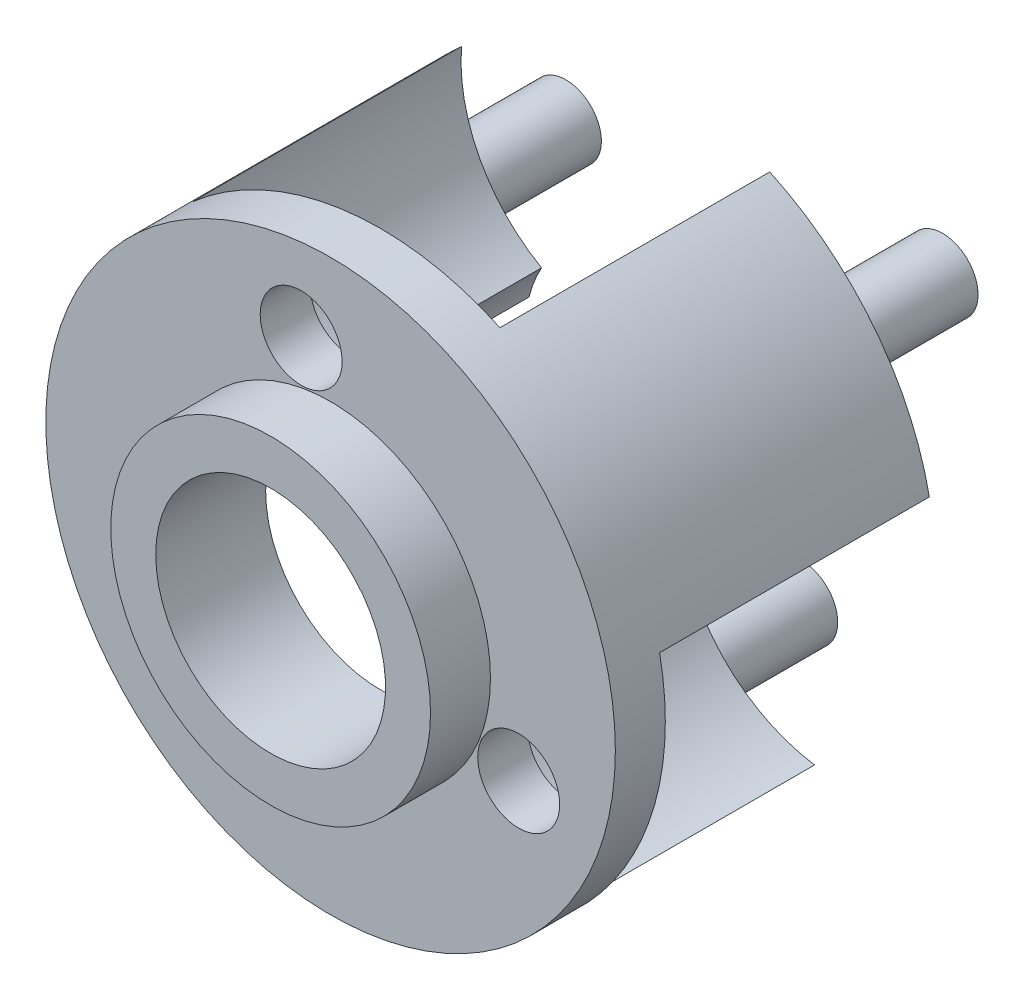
SolidWorks part; units mm, degrees
ref_plane "Plan de face" through (0, 0, 0) normal (0, 0, 1) x (1, 0, 0)
ref_plane "Plan de dessus" through (0, 0, 0) normal (0, 1, 0) x (1, 0, 0)
ref_plane "Plan de droite" through (0, 0, 0) normal (1, 0, 0) x (0, 0, -1)
sketch "Esquisse1" plane through (0, 0, 0) normal (0, 1, 0) x (1, 0, 0)
  line L0 (2.85, -3.65) -> (0, -3.65)
  line L1 (0, -3.65) -> (0, -6.85)
  line L2 (0, -6.85) -> (2.85, -6.85)
  line L3 (2.85, -6.85) -> (2.85, -3.65)
  line L4 (0, -3.65) -> (0, -6.85) construction
revolve "Révolution1" add sketch "Esquisse1" angle 360 about L4
sketch "Esquisse2" plane through (0, 0, 3.65) normal (0, 0, -1) x (-1, 0, 0)
  arc A0 (-1.1949, 2.5874) -> (-0.8656, 0.9018) centre (0.2947, 2.0034) ccw
  arc A1 (-0.8656, 0.9018) -> (-1.0763, 0.6356) centre (0, 0) ccw
  arc A2 (-1.0763, 0.6356) -> (-2.7925, 0.5694) centre (-1.8824, -0.7465) ccw
  arc A3 (-2.7925, 0.5694) -> (-1.1949, 2.5874) centre (0, 0) ccw
extrude "Enlèv. mat.-Extru.1" cut sketch "Esquisse2" against normal blind 2.7
sketch "Esquisse3" plane through (0, 0, 6.35) normal (0, 0, -1) x (-1, 0, 0)
  arc A0 (1.2138, 0.2987) -> (1.0886, 0.6143) centre (0, 0) ccw
  arc A1 (1.0886, 0.6143) -> (1.8894, 2.1337) centre (0.2947, 2.0034) ccw
  arc A2 (1.8894, 2.1337) -> (2.8382, -0.2589) centre (0, 0) cw
  arc A3 (2.8382, -0.2589) -> (1.2138, 0.2987) centre (1.5877, -1.257) ccw
extrude "Boss.-Extru.1" add sketch "Esquisse3" along normal blind 2.7
sketch "Esquisse4" plane through (0, 0, 6.35) normal (0, 0, -1) x (-1, 0, 0)
  arc A0 (-0.3482, -1.2005) -> (-0.0123, -1.2499) centre (0, 0) ccw
  arc A1 (-0.0123, -1.2499) -> (0.9031, -2.7031) centre (1.5877, -1.257) ccw
  arc A2 (0.9031, -2.7031) -> (-1.6433, -2.3285) centre (0, 0) cw
  arc A3 (-1.6433, -2.3285) -> (-0.3482, -1.2005) centre (-1.8824, -0.7465) ccw
extrude "Boss.-Extru.2" add sketch "Esquisse4" along normal blind 2.7
sketch "Esquisse5" plane through (0, 0, 6.85) normal (0, 0, 1) x (1, 0, 0)
  circle A0 centre (0, 0) radius 1.6
extrude "Boss.-Extru.3" add sketch "Esquisse5" along normal blind 0.6
ref_plane "Plan4" through (0, -2.1766, 0) normal (0, -1, 0) x (1, 0, 0)
sketch "Esquisse6" plane through (0, -2.1766, 0) normal (0, -1, 0) x (1, 0, 0)
  line L0 (0.6752, 3.65) -> (0.3202, 3.65)
  line L1 (0.3202, 3.65) -> (0.3202, 2.45)
  line L2 (0.3202, 2.45) -> (0.6752, 2.45)
  line L3 (0.6752, 2.45) -> (0.6752, 3.65)
  line L4 (0.3202, 3.65) -> (0.3202, 2.45) construction
revolve "Révolution2" add sketch "Esquisse6" angle 360 about L4
ref_plane "Plan5" through (0, 0.811, 0) normal (0, -1, 0) x (1, 0, 0)
sketch "Esquisse7" plane through (0, 0.811, 0) normal (0, -1, 0) x (1, 0, 0)
  line L0 (-1.6901, 3.65) -> (-2.0451, 3.65)
  line L1 (-2.0451, 3.65) -> (-2.0451, 2.45)
  line L2 (-2.0451, 2.45) -> (-1.6901, 2.45)
  line L3 (-1.6901, 2.45) -> (-1.6901, 3.65)
  line L4 (-2.0451, 3.65) -> (-2.0451, 2.45) construction
revolve "Révolution3" add sketch "Esquisse7" angle 360 about L4
ref_plane "Plan6" through (0, 1.3656, 0) normal (0, -1, 0) x (1, 0, 0)
sketch "Esquisse8" plane through (0, 1.3656, 0) normal (0, -1, 0) x (1, 0, 0)
  line L0 (2.0799, 3.65) -> (1.7249, 3.65)
  line L1 (1.7249, 3.65) -> (1.7249, 2.45)
  line L2 (1.7249, 2.45) -> (2.0799, 2.45)
  line L3 (2.0799, 2.45) -> (2.0799, 3.65)
  line L4 (1.7249, 3.65) -> (1.7249, 2.45) construction
revolve "Révolution4" add sketch "Esquisse8" angle 360 about L4
hole_wizard "Perçage1" positions "Esquisse10" profile "Esquisse9" legacy
sketch "Esquisse10" plane through (0, 0, 6.35) normal (0, 0, -1) x (-1, 0, 0)
  point P0 (1.5877, -1.257)
  point P1 (0.2947, 2.0034)
  point P2 (-1.8824, -0.7465)
sketch "Esquisse9" plane through (-1.5877, -1.257, 6.35) normal (1, 0, 0) x (0, 1, 0)
  line L0 (0, 0) -> (0, 1.1)
  line L1 (0, 1.1) -> (0.41, 1.1)
  line L2 (0.41, 1.1) -> (0.41, 0)
  line L3 (0.41, 0) -> (0, 0)
  line L4 (0, 110) -> (0, -10) construction
  dimension "Diamètre" = 0.82
  dimension "Profondeur" = 1.1
hole_wizard "Diamètre du perçage Ø2.3 (2.3)1" positions "Esquisse12" profile "Esquisse11" hole size "Ø2.3" standard "Ansi Métrique"
sketch "Esquisse12" plane through (0, 0, 6.35) normal (0, 0, -1) x (-1, 0, 0)
  point P0 (0, 0)
sketch "Esquisse11" plane through (0, 0, 6.35) normal (1, 0, 0) x (0, 1, 0)
  line L0 (0, 0) -> (0, 1.1)
  line L1 (0, 1.1) -> (1.15, 1.1)
  line L2 (1.15, 1.1) -> (1.15, 0)
  line L5 (1.15, 0) -> (0, 0)
  line L11 (0, -6.35) -> (0, 107.95) construction
  dimension "Diamètre du perçage jusqu'au prochain" = 2.3
  dimension "Profondeur du perçage jusqu'au prochain" = 1.1
